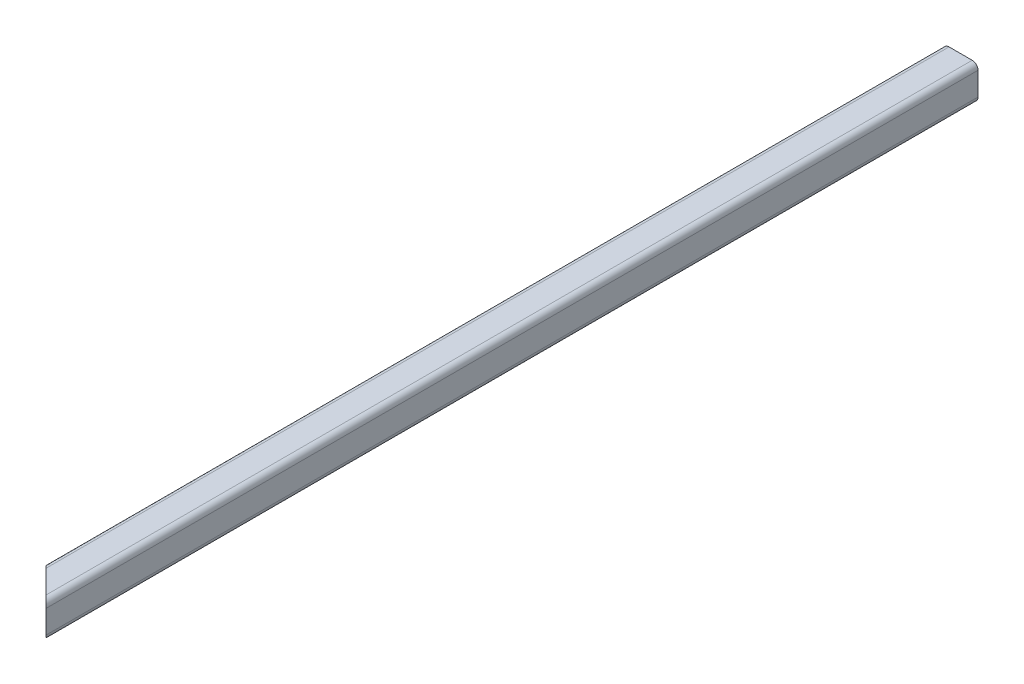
SolidWorks part; units mm, degrees
ref_plane "Plane1" through (0, 0, 0) normal (0, 0, 1) x (1, 0, 0)
ref_plane "Plane2" through (0, 0, 0) normal (0, 1, 0) x (1, 0, 0)
ref_plane "Plane3" through (0, 0, 0) normal (1, 0, 0) x (0, 0, -1)
sketch "Sketch1" plane through (0, 0, 0) normal (0, 0, 1) x (1, 0, 0)
  line L0 (-20, -25) -> (20, -25)
  line L1 (-25, -20) -> (-25, 20)
  line L2 (20, 25) -> (-20, 25)
  line L3 (25, 20) -> (25, -20)
  line L4 (-20, -30) -> (20, -30)
  line L5 (-30, -20) -> (-30, 20)
  line L6 (20, 30) -> (-20, 30)
  line L7 (30, 20) -> (30, -20)
  line L8 (-30, 0) -> (-25, 0) construction
  line L9 (-25, 0) -> (25, 0) construction
  line L10 (25, 0) -> (30, 0) construction
  line L12 (0, 30) -> (0, 25) construction
  line L13 (0, 25) -> (0, -25) construction
  line L14 (0, -25) -> (0, -30) construction
  arc A0 (30, 20) -> (20, 30) centre (20, 20) ccw
  arc A1 (20, -30) -> (30, -20) centre (20, -20) ccw
  arc A2 (-30, -20) -> (-20, -30) centre (-20, -20) ccw
  arc A3 (-20, 30) -> (-30, 20) centre (-20, 20) ccw
  arc A4 (-20, 25) -> (-25, 20) centre (-20, 20) ccw
  arc A5 (25, 20) -> (20, 25) centre (20, 20) ccw
  arc A6 (20, -25) -> (25, -20) centre (20, -20) ccw
  arc A7 (-25, -20) -> (-20, -25) centre (-20, -20) ccw
  point P2 (-30, 30)
  point P33 (-30, -30)
  point P34 (30, -30)
  point P36 (30, 30)
extrude "Extrusion1" add sketch "Sketch1" along normal blind 1610
sketch "Esquisse4" plane through (0, 30, 0) normal (0, 1, 0) x (1, 0, 0)
  line L0 (30, -1610) -> (-30, -1610)
  line L1 (-30, -1610) -> (-30, -1550)
  line L2 (-30, -1550) -> (30, -1610)
  line L5 (30, -1610) -> (30, 0) construction
  line L7 (20, -1610) -> (-20, -1610) construction
  dimension "D1" = 60
  dimension "D2" = 60
  dimension "D3" = 0
  dimension "D4" = 0
extrude "Extrusion5" cut sketch "Esquisse4" against normal through all
